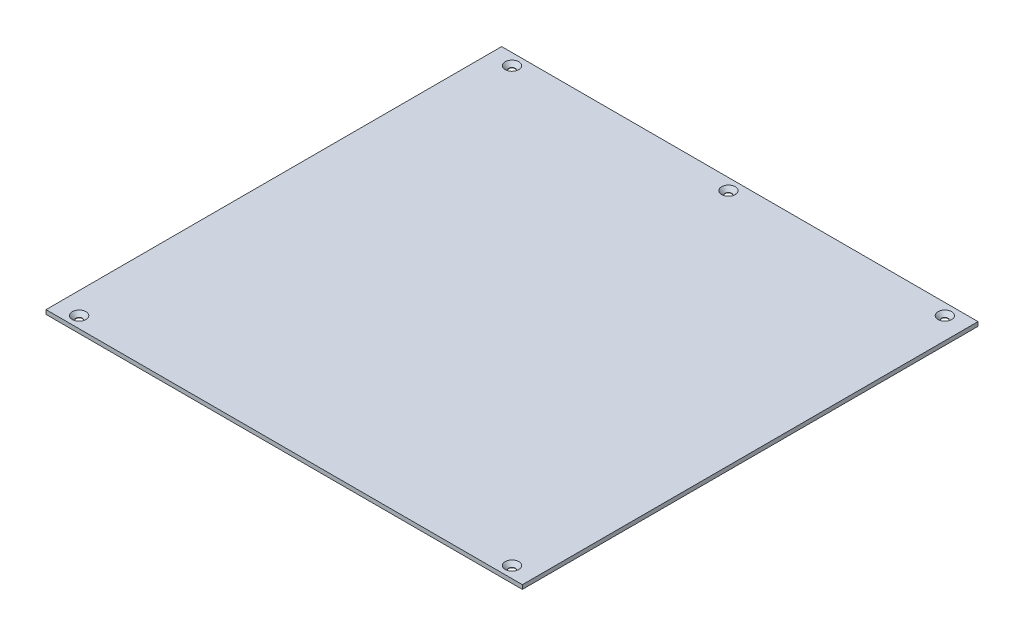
SolidWorks part; units mm, degrees
ref_plane "Alzado" through (0, 0, 0) normal (0, 0, 1) x (1, 0, 0)
ref_plane "Planta" through (0, 0, 0) normal (0, 1, 0) x (1, 0, 0)
ref_plane "Vista lateral" through (0, 0, 0) normal (1, 0, 0) x (0, 0, -1)
sketch "Croquis1" plane through (0, 0, 0) normal (0, 1, 0) x (1, 0, 0)
  line L0 (0, 167.2443) -> (0, 0) construction
  line L2 (-115, -110) -> (115, -110)
  line L3 (-115, -110) -> (-115, 110)
  line L4 (-115, 110) -> (115, 110)
  line L5 (0, 0) -> (277.7522, 0) construction
  line L6 (115, -110) -> (115, 110)
  line L7 (-115, -110) -> (115, 110) construction
  line L8 (-115, 110) -> (115, -110) construction
  circle A0 centre (104.5, 104.5) radius 1.5
  circle A1 centre (-104.5, 104.5) radius 1.5
  circle A2 centre (104.5, -104.5) radius 1.5
  circle A3 centre (-104.5, -104.5) radius 1.5
  circle A4 centre (0, 104.5) radius 1.5
  dimension "D2" = 209
  dimension "D3" = 3
  dimension "D4" = 209
  dimension "D5" = 230
  dimension "D1" = 220
extrude "Saliente-Extruir2" add sketch "Croquis1" along normal blind 2
chamfer "Фаска1" distance 1.8 angle 45 5 edges at (-104.5, 2, 106) (104.5, 2, 103) (-104.5, 2, -106) (104.5, 2, -103) (0, 2, -103)
